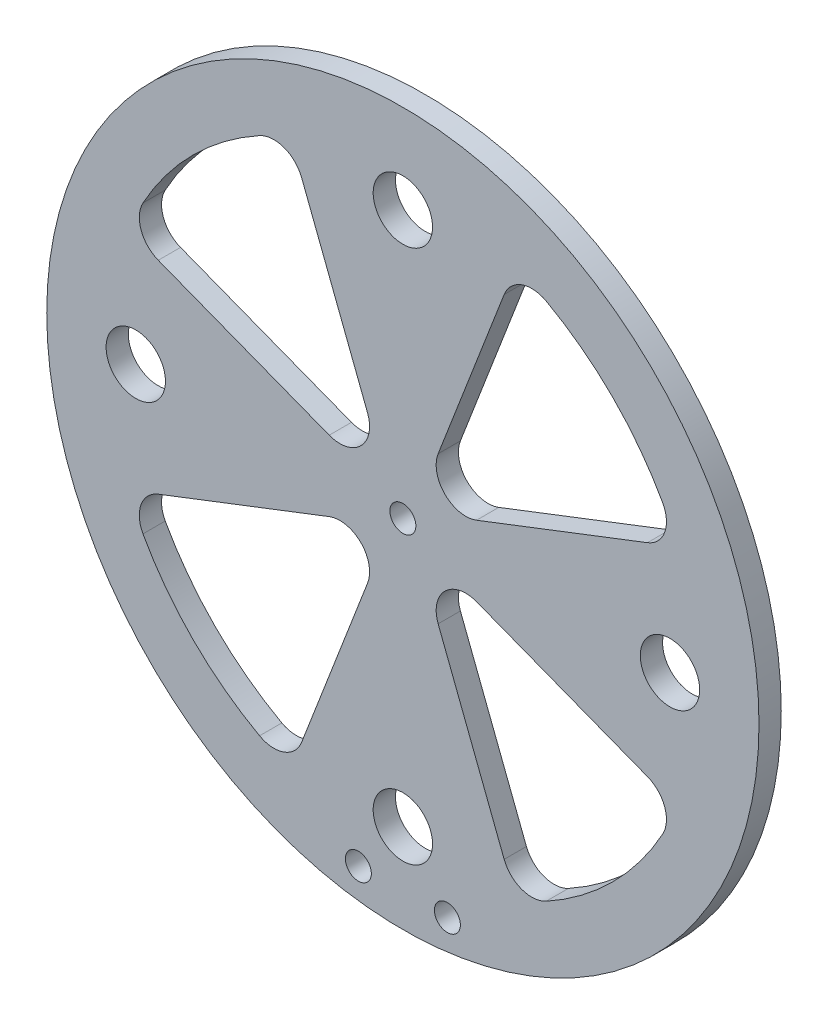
SolidWorks part; units mm, degrees
ref_plane "Front Plane" through (0, 0, 0) normal (0, 0, 1) x (1, 0, 0)
ref_plane "Top Plane" through (0, 0, 0) normal (0, 1, 0) x (1, 0, 0)
ref_plane "Right Plane" through (0, 0, 0) normal (1, 0, 0) x (0, 0, -1)
sketch "Sketch1" plane through (0, 0, 0) normal (0, 0, 1) x (1, 0, 0)
  line L0 (0, 0) -> (33.9411, 33.9411) construction
  line L1 (0, 0) -> (48, 0) construction
  line L2 (4.7539, 9.9263) -> (13.6516, 32.9661)
  line L3 (9.9263, 4.7539) -> (32.9661, 13.6516)
  line L4 (-4.7539, 9.9263) -> (-13.6516, 32.9661)
  line L5 (-9.9263, 4.7539) -> (-32.9661, 13.6516)
  line L6 (-9.9263, -4.7539) -> (-32.9661, -13.6516)
  line L7 (-4.7539, -9.9263) -> (-13.6516, -32.9661)
  line L8 (4.7539, -9.9263) -> (13.6516, -32.9661)
  line L9 (9.9263, -4.7539) -> (32.9661, -13.6516)
  line L10 (0, 0) -> (0, -48) construction
  circle A0 centre (0, 0) radius 48
  circle A1 centre (0, 0) radius 36 construction
  circle A2 centre (0, 36) radius 4
  circle A3 centre (36, 0) radius 4
  circle A4 centre (0, -36) radius 4
  circle A5 centre (-36, 0) radius 4
  arc A6 (19.3144, 35.0279) -> (13.6516, 32.9661) centre (17.383, 31.5251) ccw
  arc A7 (32.9661, 13.6516) -> (35.0279, 19.3144) centre (31.5251, 17.383) ccw
  arc A8 (35.0279, 19.3144) -> (19.3144, 35.0279) centre (0, 0) ccw
  circle A9 centre (0, 0) radius 12 construction
  arc A10 (4.7539, 9.9263) -> (9.9263, 4.7539) centre (8.4853, 8.4853) ccw
  arc A11 (-9.9263, 4.7539) -> (-4.7539, 9.9263) centre (-8.4853, 8.4853) ccw
  arc A12 (-35.0279, 19.3144) -> (-32.9661, 13.6516) centre (-31.5251, 17.383) ccw
  arc A13 (-19.3144, 35.0279) -> (-35.0279, 19.3144) centre (0, 0) ccw
  arc A14 (-13.6516, 32.9661) -> (-19.3144, 35.0279) centre (-17.383, 31.5251) ccw
  arc A15 (-4.7539, -9.9263) -> (-9.9263, -4.7539) centre (-8.4853, -8.4853) ccw
  arc A16 (-19.3144, -35.0279) -> (-13.6516, -32.9661) centre (-17.383, -31.5251) ccw
  arc A17 (-35.0279, -19.3144) -> (-19.3144, -35.0279) centre (0, 0) ccw
  arc A18 (-32.9661, -13.6516) -> (-35.0279, -19.3144) centre (-31.5251, -17.383) ccw
  arc A19 (9.9263, -4.7539) -> (4.7539, -9.9263) centre (8.4853, -8.4853) ccw
  arc A20 (35.0279, -19.3144) -> (32.9661, -13.6516) centre (31.5251, -17.383) ccw
  arc A21 (19.3144, -35.0279) -> (35.0279, -19.3144) centre (0, 0) ccw
  arc A22 (13.6516, -32.9661) -> (19.3144, -35.0279) centre (17.383, -31.5251) ccw
  circle A23 centre (0, 0) radius 1.75
  circle A24 centre (0, 0) radius 44 construction
  circle A25 centre (6, -43.589) radius 1.75
  circle A26 centre (-6, -43.589) radius 1.75
  dimension "D1" = 96
  dimension "D2" = 72
  dimension "D3" = 8
  dimension "D5" = 20
  dimension "D6" = 10
  dimension "D7" = 24
  dimension "D8" = 3.5
  dimension "D9" = 88
  dimension "D10" = 6
  dimension "D11" = 12
  dimension "D4" = 45
extrude "Extrude1" add sketch "Sketch1" along normal blind 3
